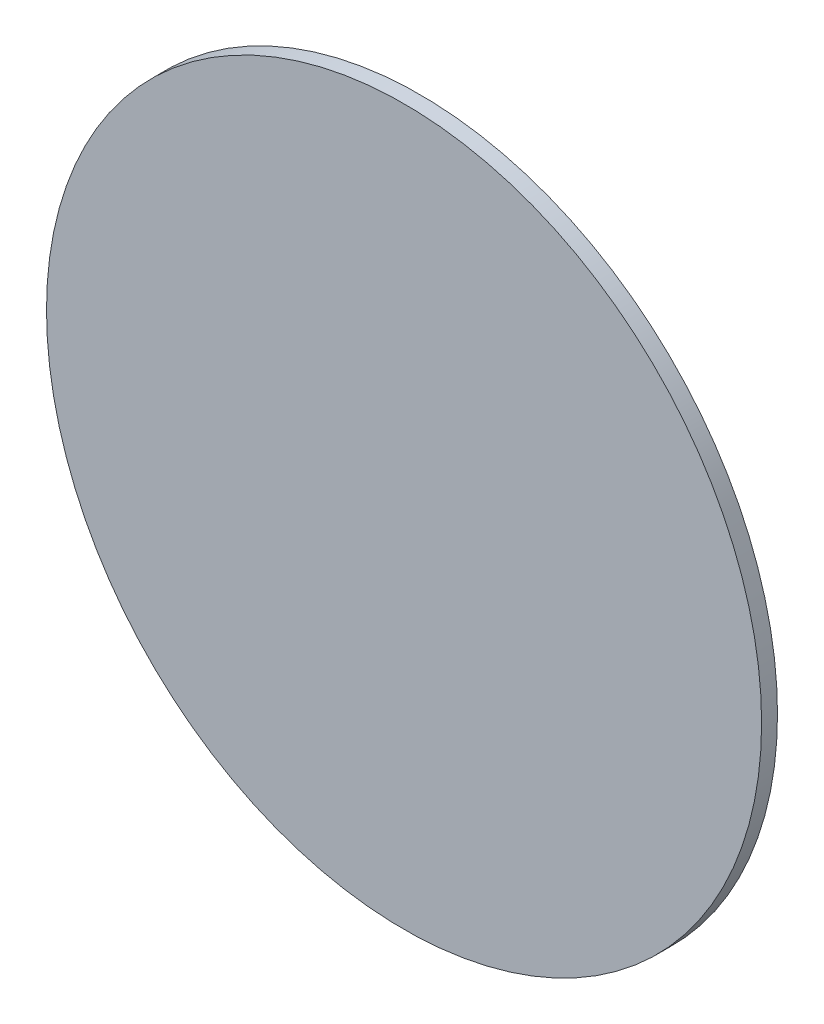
SolidWorks part; units mm, degrees
ref_plane "Plan de face" through (0, 0, 0) normal (0, 0, 1) x (1, 0, 0)
ref_plane "Plan de dessus" through (0, 0, 0) normal (0, 1, 0) x (1, 0, 0)
ref_plane "Plan de droite" through (0, 0, 0) normal (1, 0, 0) x (0, 0, -1)
sketch "Esquisse1" plane through (0, 0, 0) normal (0, 0, 1) x (1, 0, 0)
  circle A0 centre (0, 0) radius 22.5
  dimension "D1" = 45
extrude "Boss.-Extru.1" add sketch "Esquisse1" along normal blind 1
